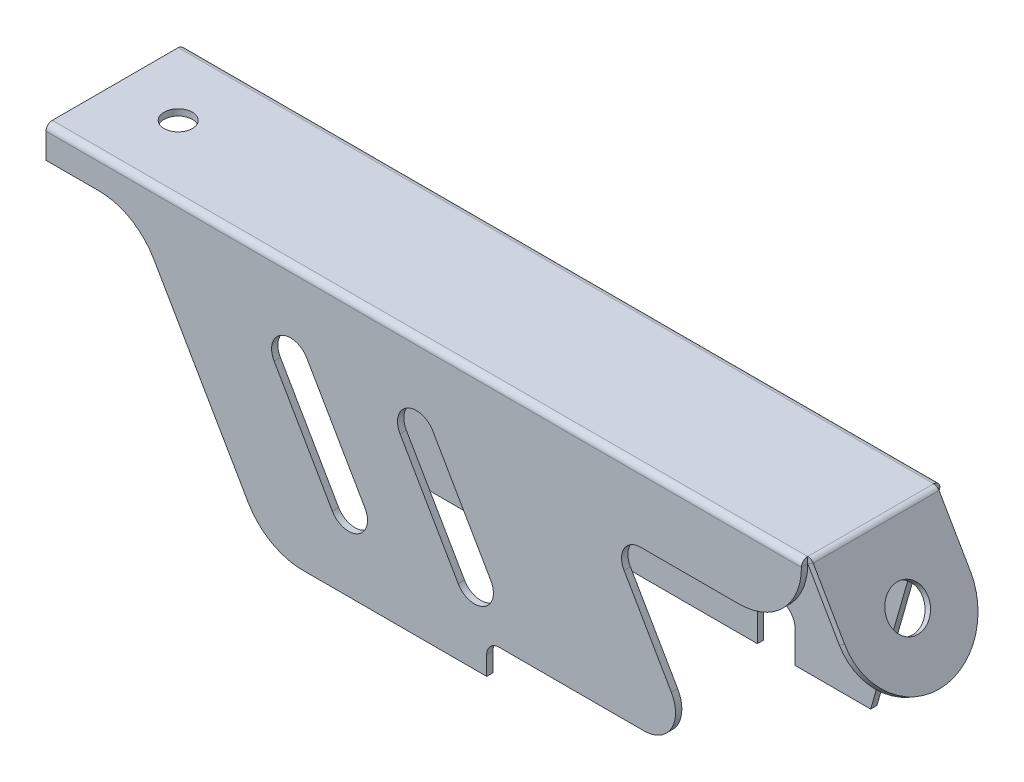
SolidWorks part; units mm, degrees
ref_plane "Front Plane" through (0, 0, 0) normal (0, 0, 1) x (1, 0, 0)
ref_plane "Top Plane" through (0, 0, 0) normal (0, 1, 0) x (1, 0, 0)
ref_plane "Right Plane" through (0, 0, 0) normal (1, 0, 0) x (0, 0, -1)
sketch "Sketch2" plane through (0, 0, 0) normal (0, 1, 0) x (1, 0, 0)
  line L0 (0, 0) -> (130, 0) construction
  line L1 (130, 10) -> (120, 10)
  line L2 (120, 10) -> (110, 45)
  line L3 (110, 45) -> (98, 45)
  line L4 (98, 45) -> (98, 40)
  line L5 (130, -10) -> (120, -10)
  line L6 (92, 40) -> (92, 45)
  line L7 (92, 45) -> (72, 45)
  line L8 (70, 47) -> (70, 50)
  line L9 (70, 50) -> (40.7735, 50)
  line L10 (32.1132, 45) -> (17.1021, 19)
  line L11 (8.4419, 14) -> (0, 14)
  line L12 (0, 14) -> (0, -14)
  line L13 (95, -45) -> (72, -45)
  line L14 (70, -47) -> (70, -50)
  line L15 (70, -50) -> (40.7735, -50)
  line L16 (32.1132, -45) -> (17.1021, -19)
  line L17 (8.4419, -14) -> (0, -14)
  line L18 (99.3301, -37.5) -> (91.8246, -24.5)
  line L19 (94.4226, -20) -> (110, -20)
  line L20 (50, 50) -> (29.2909, 14.1308) construction
  line L21 (55, -50) -> (33.4067, -12.5993) construction
  line L22 (75, -50) -> (53.1734, -12.1952) construction
  line L23 (50.6699, -36.5) -> (41.4323, -20.5)
  line L24 (72.4019, -51.5) -> (50.5753, -13.6952) construction
  line L26 (65.4737, -39.5) -> (56.2361, -23.5)
  line L27 (70.6699, -36.5) -> (61.4323, -20.5)
  line L28 (57.5981, -48.5) -> (36.0048, -11.0993) construction
  line L30 (45.4737, -39.5) -> (36.2361, -23.5)
  circle A0 centre (130, 0) radius 3.25
  arc A1 (130, -10) -> (130, 10) centre (130, 0) ccw
  arc A2 (92, 40) -> (98, 40) centre (95, 40) ccw
  arc A3 (72, -45) -> (70, -47) centre (72, -47) ccw
  arc A4 (99.3301, -37.5) -> (95, -45) centre (95, -40) cw
  arc A5 (72, 45) -> (70, 47) centre (72, 47) cw
  arc A6 (91.8246, -24.5) -> (94.4226, -20) centre (94.4226, -23) cw
  arc A7 (110, -20) -> (120, -10) centre (110, -10) ccw
  circle A8 centre (10, 0) radius 2.25
  circle A9 centre (43.453, 38.6603) radius 3
  circle A10 centre (38.453, 30) radius 2.25
  circle A11 centre (106.453, 30) radius 2.25
  arc A12 (41.4323, -20.5) -> (36.2361, -23.5) centre (38.8342, -22) ccw
  arc A13 (61.4323, -20.5) -> (56.2361, -23.5) centre (58.8342, -22) ccw
  arc A14 (45.4737, -39.5) -> (50.6699, -36.5) centre (48.0718, -38) ccw
  arc A15 (65.4737, -39.5) -> (70.6699, -36.5) centre (68.0718, -38) ccw
  arc A16 (17.1021, 19) -> (8.4419, 14) centre (8.4419, 24) cw
  arc A17 (40.7735, 50) -> (32.1132, 45) centre (40.7735, 40) ccw
  arc A18 (40.7735, -50) -> (32.1132, -45) centre (40.7735, -40) cw
  arc A19 (8.4419, -14) -> (17.1021, -19) centre (8.4419, -24) cw
  point P63 (14.2154, 14)
  point P71 (35, 50)
  point P74 (35, -50)
  point P77 (14.2154, -14)
  dimension "D1" = 35
  dimension "D2" = 2
  dimension "D4" = 10
  dimension "D5" = 6.5
  dimension "D12" = 3
  dimension "D19" = 5
  dimension "D20" = 3
  dimension "D21" = 10
  dimension "D22" = 10
  dimension "D23" = 25
  dimension "D28" = 4.5
  dimension "D29" = 10
  dimension "D32" = 10
  dimension "D33" = 6
  dimension "D34" = 4.5
  dimension "D35" = 20
  dimension "D36" = 4.5
  dimension "D37" = 30
  dimension "D38" = 68
  dimension "D42" = 6
  dimension "D51" = 10
  dimension "D3" = 10
  dimension "D6" = 10
  dimension "D7" = 15
  dimension "D8" = 25
  dimension "D9" = 14
  dimension "D10" = 5
  dimension "D11" = 5
  dimension "D13" = 45
  dimension "D14" = 45
  dimension "D15" = 50
  dimension "D16" = 120
  dimension "D17" = 35
  dimension "D18" = 10
  dimension "D24" = 60
  dimension "D25" = 10
  dimension "D26" = 3
  dimension "D27" = 3
  dimension "D30" = 120
  dimension "D31" = 15
  dimension "D39" = 20
  dimension "D40" = 60
  dimension "D41" = 5
  dimension "D45" = 12
  dimension "D46" = 12
  dimension "D47" = 16
  dimension "D48" = 16
  dimension "D49" = 3
  dimension "D50" = 3
  dimension "D43" = 3
  dimension "D44" = 3
sheet metal parameters "Sheet-Metal1" thickness 1 parameters "D1"=0.0001
base flange "Base-Flange1" sketch "Sketch2" thickness 1 reverse thickness direction yes parameters "D1"=0.0001
sketch "Sketch3" plane through (0, 1, 0) normal (0, 1, 0) x (1, 0, 0)
  line L0 (120, 10) -> (0, 10)
  line L1 (0, 14) -> (0, -14) construction
sketched bend "Sketched Bend3" parameters "D1"=0.001
bend "SketchBend3" bend radius 0.001 bend angle 90 parameters "D5"=1
sketch "Sketch4" plane through (0, 1, 0) normal (0, 1, 0) x (1, 0, 0)
  line L0 (120, -10) -> (0, -10)
  line L1 (0, 10) -> (0, -14) construction
sketched bend "Sketched Bend4" parameters "D1"=0.001
bend "SketchBend4" bend radius 0.001 bend angle 90 parameters "D5"=2
sketch "Sketch5" plane through (0, 1, 0) normal (0, 1, 0) x (1, 0, 0)
  line L0 (120, 10) -> (120, -10)
sketched bend "Sketched Bend5" parameters "D1"=0.001
bend "SketchBend5" bend radius 0.001 bend angle 60 parameters "D5"=3
flat pattern "Flat-Pattern1"
sketch "Bend-Lines1" plane through (0, 1, 0) normal (0, 1, 0) x (-1, 0, 0)
  line L0 (-120.0005, 10) -> (-120.0005, -10) construction
  line L1 (0, 10.0008) -> (-120, 10.0008) construction
  line L2 (0, -10.0008) -> (-119.9998, -10.0008) construction
  line L3 (-120.0005, 10) -> (-120.0005, -10) construction
  line L4 (0, 10.0008) -> (-120, 10.0008) construction
  line L5 (0, -10.0008) -> (-119.9998, -10.0008) construction
  point P2 (0, 10.0001)
  point P3 (-120, 10.0001)
bend of the flat pattern "Flatten-<SketchBend3>1"
bend of the flat pattern "Flatten-<SketchBend4>1"
bend of the flat pattern "Flatten-<SketchBend5>1"
